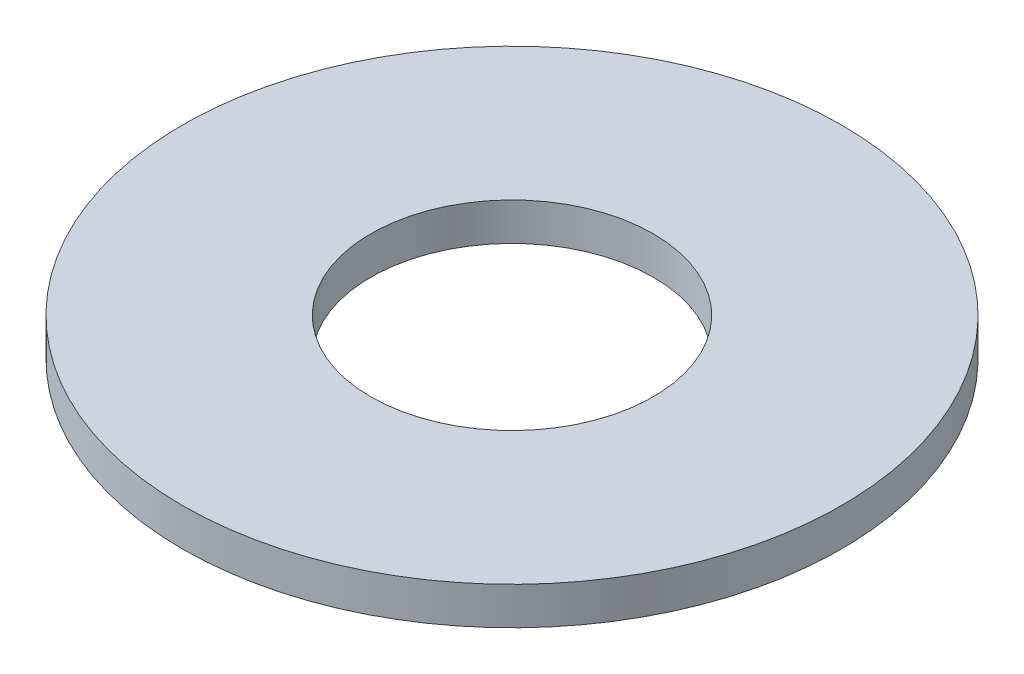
SolidWorks part; units mm, degrees
ref_plane "Front Plane" through (0, 0, 0) normal (0, 0, 1) x (1, 0, 0)
ref_plane "Top Plane" through (0, 0, 0) normal (0, 1, 0) x (1, 0, 0)
ref_plane "Right Plane" through (0, 0, 0) normal (1, 0, 0) x (0, 0, -1)
sketch "Sketch1" plane through (0, 0, 0) normal (0, 1, 0) x (1, 0, 0)
  circle A0 centre (0, 0) radius 9.525
  circle A1 centre (0, 0) radius 22.225
  dimension "D1" = 19.05
  dimension "D2" = 12.7
extrude "Boss-Extrude1" add sketch "Sketch1" along normal blind 2.54
